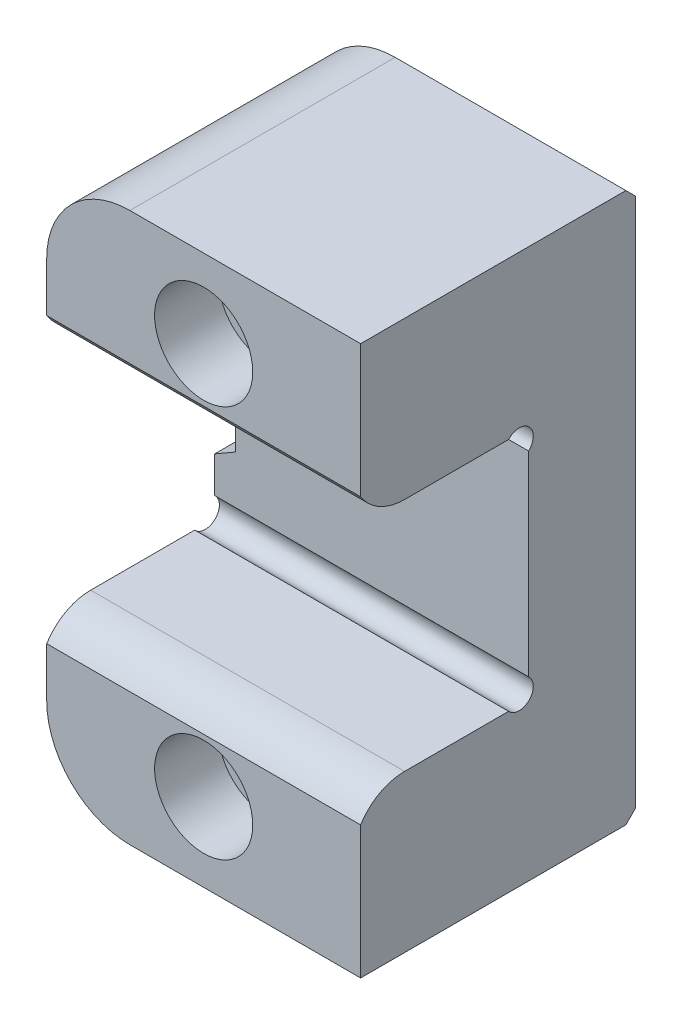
SolidWorks part; units mm, degrees
ref_plane "Front Plane" through (0, 0, 0) normal (0, 0, 1) x (1, 0, 0)
ref_plane "Top Plane" through (0, 0, 0) normal (0, 1, 0) x (1, 0, 0)
ref_plane "Right Plane" through (0, 0, 0) normal (1, 0, 0) x (0, 0, -1)
sketch "Sketch1" plane through (0, 0, 0) normal (1, 0, 0) x (0, 0, -1)
  line L0 (0, 0) -> (50000, 0) construction
  line L1 (0, 19.05) -> (27.178, 19.05)
  line L2 (0, 44.45) -> (44.45, 44.45)
  line L3 (0, 44.45) -> (0, 19.05)
  line L4 (0, -44.45) -> (44.45, -44.45)
  line L5 (44.45, 44.45) -> (44.45, -44.45)
  line L6 (27.178, 19.05) -> (27.178, -19.05)
  line L7 (27.178, -19.05) -> (0, -19.05)
  line L9 (0, 27.94) -> (0, -27.94) construction
  line L10 (0, -19.05) -> (0, -44.45)
  dimension "D1" = 44.45
  dimension "D2" = 88.9
  dimension "D3" = 27.178
  dimension "D4" = 38.1
extrude "Extrude1" add sketch "Sketch1" along normal mid plane 50.8
fillet "Fillet1" radius 13.462 2 edges at (-25.4, -44.45, -22.225) (-25.4, 44.45, -22.225)
sketch "Sketch2" plane through (-19.05, 0, -44.45) normal (0, 0, 1) x (1, 0, 0)
  line L0 (0, 0) -> (50000, 0) construction
  line L1 (44.45, -44.45) -> (44.45, 44.45) construction
  line L2 (42.0687, 8.6085) -> (45.2437, 10.4415) construction
  line L3 (42.0687, 8.6085) -> (42.0687, -8.6085) construction
  line L4 (42.0687, -8.6085) -> (45.2437, -10.4415) construction
  line L5 (45.2437, 10.4415) -> (45.2437, -10.4415) construction
  line L6 (19.05, 0) -> (19.05, 50000) construction
  line L7 (-7.1438, 10.4415) -> (-7.1438, -10.4415)
  line L8 (-3.9688, -8.6085) -> (-7.1438, -10.4415)
  line L9 (-3.9688, 8.6085) -> (-3.9688, -8.6085)
  line L10 (-3.9688, 8.6085) -> (-7.1438, 10.4415)
  point P4 (43.6562, 9.525)
  point P10 (43.6562, -9.525)
  point P13 (-5.5563, -9.525)
  point P14 (-5.5563, 9.525)
  dimension "D1" = 19.05
  dimension "D2" = 2.3813
  dimension "D3" = 30
  dimension "D4" = 3.175
extrude "Cut-Extrude1" cut sketch "Sketch2" along normal through all
sketch "Sketch5" plane through (25.4, 0, 0) normal (1, 0, 0) x (0, 0, -1)
  line L0 (0, 0) -> (50000, 0) construction
  line L2 (0, 44.45) -> (0, 19.05) construction
  line L3 (0, -19.05) -> (0, -44.45) construction
  line L4 (-5.588, -13.4703) -> (7.112, -13.4703)
  line L5 (-5.588, -13.4703) -> (-5.588, -22.9953)
  line L6 (-5.588, -22.9953) -> (0, -22.9953)
  line L7 (7.112, -13.4703) -> (7.112, -19.05)
  line L8 (27.178, -19.05) -> (0, -19.05) construction
  line L9 (7.112, 13.4703) -> (7.112, 19.05)
  line L10 (-5.588, 22.9953) -> (0, 22.9953)
  line L11 (-5.588, 13.4703) -> (-5.588, 22.9953)
  line L12 (-5.588, 13.4703) -> (7.112, 13.4703)
  arc A0 (1.7646, -20.2306) -> (7.112, -19.05) centre (7.112, -31.75) cw construction
  arc A1 (0, -22.9953) -> (1.7646, -20.2306) centre (3.048, -22.9953) cw construction
  arc A2 (0, 22.9953) -> (1.7646, 20.2306) centre (3.048, 22.9953) ccw construction
  arc A3 (1.7646, 20.2306) -> (7.112, 19.05) centre (7.112, 31.75) ccw construction
  arc A4 (0, -22.9953) -> (7.112, -19.05) centre (7.112, -27.4329) cw
  arc A5 (0, 22.9953) -> (7.112, 19.05) centre (7.112, 27.4329) ccw
  dimension "D1" = 3.048
  dimension "D2" = 12.7
  dimension "D3" = 9.525
  dimension "D4" = 12.7
  dimension "D5" = 7.112
extrude "Cut-Extrude2" cut sketch "Sketch5" against normal through all
sketch "Sketch6" plane through (25.4, 0, 0) normal (1, 0, 0) x (0, 0, -1)
  line L0 (0, 0) -> (50000, 0) construction
  line L3 (27.178, 19.05) -> (27.178, -19.05) construction
  line L4 (7.112, 19.05) -> (27.178, 19.05) construction
  circle A0 centre (25.654, 17.526) radius 2.286
  circle A1 centre (25.654, -17.526) radius 2.286
  dimension "D2" = 0.762
  dimension "D3" = 2.286
  dimension "D1" = 0.762
extrude "Cut-Extrude3" cut sketch "Sketch6" against normal through all
hole_wizard "3/8\"-16 CBORE" positions "Sketch4" profile "Sketch3" counterbore size "3/8" standard "Ansi Inch"
sketch "Sketch4" plane through (0, 0, 0) normal (0, 0, 1) x (1, 0, 0)
  line L0 (0, 0) -> (0, 50000) construction
  line L1 (0, 0) -> (50000, 0) construction
  point P0 (0, 31.75)
  point P12 (0, -31.75)
  dimension "D1" = 63.5
sketch "Sketch3" plane through (0, 31.75, 0) normal (1, 0, 0) x (0, -1, 0)
  line L0 (0, 0) -> (0, 44.45)
  line L1 (0, 44.45) -> (5.1587, 44.45)
  line L3 (5.1587, 44.45) -> (5.1587, 10.3187)
  line L4 (5.1587, 10.3187) -> (7.9375, 10.3187)
  line L5 (7.9375, 10.3187) -> (7.9375, 0)
  line L7 (7.9375, 0) -> (0, 0)
  line L11 (0, -6.35) -> (0, 107.95) construction
  dimension "Thru Hole Dia." = 10.3175
  dimension "Thru Hole Depth" = 44.45
  dimension "C'Bore Dia." = 15.875
  dimension "C'Bore Depth" = 10.3187
chamfer "Chamfer3" distance 3.81 angle 15 1 edges at (-23.0187, 0, -27.178)
chamfer "Chamfer1" distance 1.524 angle 45 6 edges at (-25.4, -20.4856, -44.45) (-21.4571, -40.5071, -44.45) (6.731, -44.45, -44.45) (6.731, 44.45, -44.45) (-25.4, 20.4856, -44.45) (-21.4571, 40.5071, -44.45)
